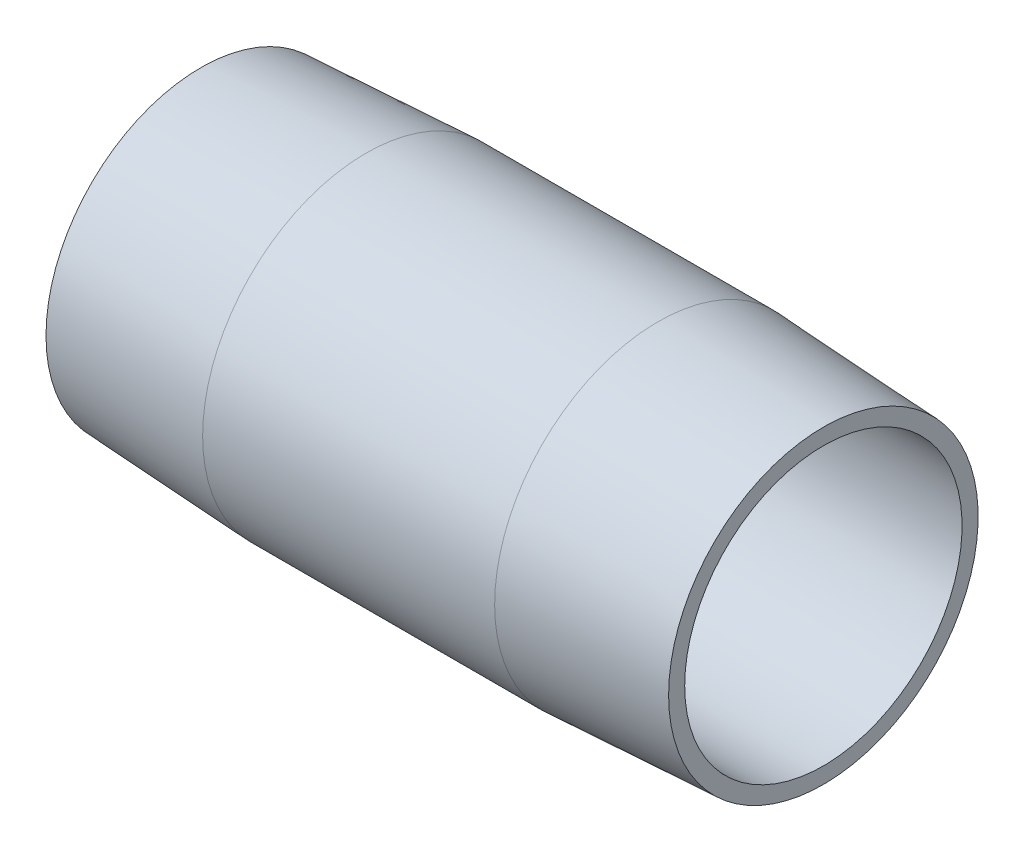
SolidWorks part; units mm, degrees
ref_plane "Front Plane" through (0, 0, 0) normal (0, 0, 1) x (1, 0, 0)
ref_plane "Top Plane" through (0, 0, 0) normal (0, 1, 0) x (1, 0, 0)
ref_plane "Right Plane" through (0, 0, 0) normal (1, 0, 0) x (0, 0, -1)
sketch "Sketch1" plane through (0, 0, 0) normal (0, 1, 0) x (1, 0, 0)
  line L5 (50.8, 11.3157) -> (0, 11.3157)
  line L6 (13.4874, 13.335) -> (0, 12.6281)
  line L7 (37.3126, 13.335) -> (13.4874, 13.335)
  line L8 (50.8, 12.6281) -> (37.3126, 13.335)
  line L9 (50.8, 11.3157) -> (50.8, 12.6281)
  line L10 (0, 11.3157) -> (0, 12.6281)
  line L11 (0, 0) -> (50000, 0) construction
  dimension "D1" = 50.8
  dimension "D2" = 26.6699
  dimension "D3" = 22.6313
  dimension "D4" = 13.4874
  dimension "D5" = 13.4874
  dimension "D6" = 3
  dimension "D7" = 3
revolve "Revolve1" add sketch "Sketch1" angle 360 about L11
